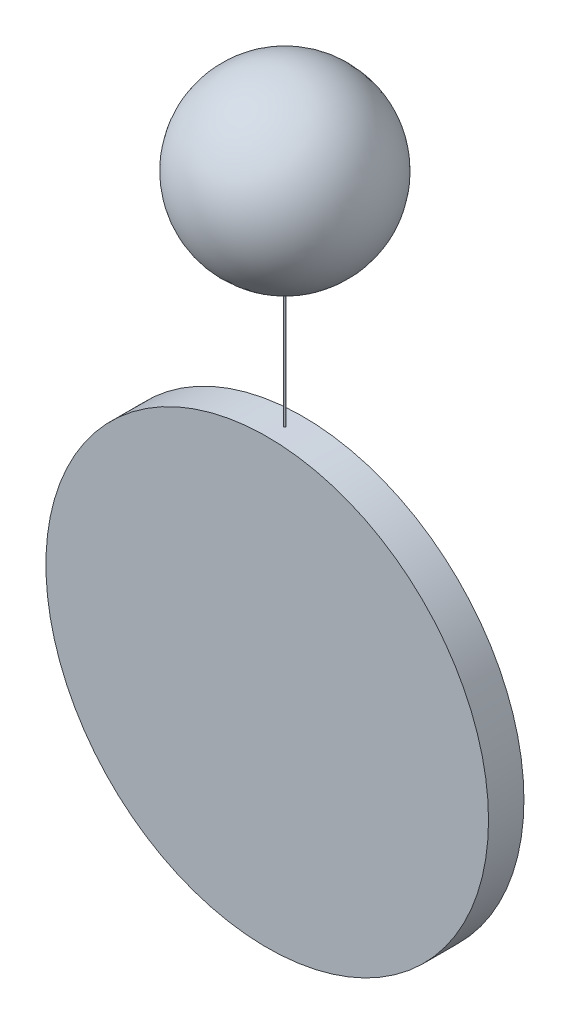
SolidWorks part; units mm, degrees
ref_plane "Front" through (0, 0, 0) normal (0, 0, 1) x (1, 0, 0)
ref_plane "Top" through (0, 0, 0) normal (0, 1, 0) x (1, 0, 0)
ref_plane "Right" through (0, 0, 0) normal (1, 0, 0) x (0, 0, -1)
sketch "HANDLE SIZE" plane through (0, 0, 0) normal (0, 0, -1) x (0, -1, 0)
  line L0 (0, 0) -> (100, 0) construction
sketch "Sketch1" plane through (0, 0, 0) normal (0, 0, 1) x (1, 0, 0)
  line L0 (5, 0) -> (-5, 0)
  line L1 (-5, 0) -> (-13.664, 0) construction
  arc A0 (-5, 0) -> (5, 0) centre (0, 0) ccw
  dimension "D1" = 10
revolve "Base-Revolve" add sketch "Sketch1" angle 360 about L1
sketch "Sketch2" plane through (0, 0, 0) normal (0, 0, 1) x (1, 0, 0)
  circle A0 centre (0, 0) radius 3
  dimension "D1" = 6
extrude "Cut-Extrude1" cut sketch "Sketch2" against normal through all
sketch "Sketch3" plane through (0, 0, 0) normal (0, 1, 0) x (1, 0, 0)
  circle A0 centre (0, 0) radius 3
  dimension "D1" = 6
extrude "Cut-Extrude2" cut sketch "Sketch3" against normal through all
sketch "Sketch5" plane through (0, 0, 0) normal (0, 1, 0) x (1, 0, 0)
  circle A0 centre (0, 0) radius 0.05
  dimension "D1" = 0.1
extrude "Boss-Extrude2" add sketch "Sketch5" against normal blind 25
sketch "Sketch8" plane through (0, 0, 0) normal (0, 0, 1) x (1, 0, 0)
  line L0 (-0.05, -25) -> (0.05, -25) construction
  line L1 (0.05, -25) -> (0.05, 0) construction
  circle A0 centre (0, -25) radius 12.5001
  point P5 (0.05, -12.5)
extrude "Boss-Extrude5" add sketch "Sketch8" along normal mid plane 2
equation "\"D1@Boss-Extrude2\" = \"D1@HANDLE SIZE\"*0.25"
